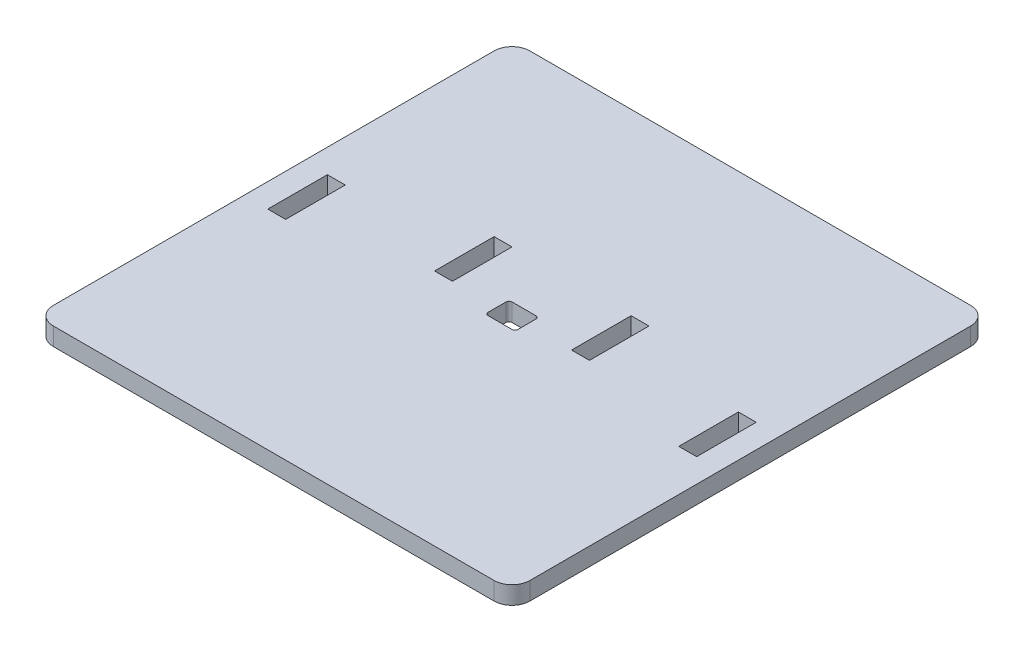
SolidWorks part; units mm, degrees
ref_plane "Front Plane" through (0, 0, 0) normal (0, 0, 1) x (1, 0, 0)
ref_plane "Top Plane" through (0, 0, 0) normal (0, 1, 0) x (1, 0, 0)
ref_plane "Right Plane" through (0, 0, 0) normal (1, 0, 0) x (0, 0, -1)
sketch "Sketch1" plane through (0, 0, 0) normal (0, 1, 0) x (1, 0, 0)
  line L0 (0, 0) -> (0, 160) construction
  line L1 (-74, 0) -> (74, 0)
  line L2 (-80, 6) -> (-80, 154)
  line L3 (-74, 160) -> (74, 160)
  line L4 (80, 6) -> (80, 154)
  line L5 (-72, 90) -> (-66, 90)
  line L6 (-72, 90) -> (-72, 70)
  line L7 (-72, 70) -> (-66, 70)
  line L8 (-66, 90) -> (-66, 70)
  line L9 (72, 70) -> (66, 70)
  line L10 (66, 90) -> (66, 70)
  line L11 (72, 90) -> (66, 90)
  line L12 (72, 90) -> (72, 70)
  arc A0 (74, 160) -> (80, 154) centre (74, 154) cw
  arc A1 (74, 0) -> (80, 6) centre (74, 6) ccw
  arc A2 (-74, 0) -> (-80, 6) centre (-74, 6) cw
  arc A3 (-80, 154) -> (-74, 160) centre (-74, 154) cw
  point P4 (0, 0)
  point P10 (-72, 80)
  point P11 (-80, 80)
  point P22 (80, 0)
  point P25 (-80, 0)
  point P28 (-80, 160)
  dimension "D6" = 6
  dimension "D1" = 6
  dimension "D2" = 8
  dimension "D3" = 160
  dimension "D4" = 160
  dimension "D5" = 20
extrude "Boss-Extrude1" add sketch "Sketch1" along normal blind 6
sketch "Sketch2" plane through (0, 6, 0) normal (0, 1, 0) x (1, 0, 0)
  line L0 (0, 0) -> (0, 160) construction
  line L1 (-74, 0) -> (74, 0) construction
  line L2 (74, 160) -> (-74, 160) construction
  line L3 (80, 80) -> (-80, 80) construction
  line L4 (80, 6) -> (80, 154) construction
  line L5 (-80, 154) -> (-80, 6) construction
  line L6 (26, 100) -> (20, 100)
  line L7 (-26, 80) -> (-20, 80)
  line L8 (-26, 80) -> (-26, 100)
  line L9 (-26, 100) -> (-20, 100)
  line L10 (-20, 80) -> (-20, 100)
  line L11 (20, 80) -> (20, 100)
  line L12 (26, 80) -> (20, 80)
  line L13 (26, 80) -> (26, 100)
  dimension "D1" = 6
  dimension "D2" = 20
  dimension "D3" = 20
extrude "Cut-Extrude1" cut sketch "Sketch2" against normal through all
sketch "Sketch3" plane through (0, 6, 0) normal (0, 1, 0) x (1, 0, 0)
  line L0 (0, 0) -> (0, 160) construction
  line L1 (74, 160) -> (-74, 160) construction
  line L2 (-80, 80) -> (80, 80) construction
  line L3 (-80, 154) -> (-80, 6) construction
  line L4 (80, 6) -> (80, 154) construction
  line L6 (-5, 84) -> (5, 84)
  line L7 (-5, 84) -> (-5, 76)
  line L8 (-5, 76) -> (5, 76)
  line L9 (5, 84) -> (5, 76)
  line L10 (-5, 84) -> (5, 76) construction
  line L11 (-5, 76) -> (5, 84) construction
  point P11 (0, 80)
  dimension "D1" = 8
  dimension "D2" = 10
extrude "Cut-Extrude2" cut sketch "Sketch3" against normal through all and the other way through all
fillet "Fillet1" radius 1 4 edges at (5, 3, -76) (-5, 3, -76) (5, 3, -84) (-5, 3, -84)
